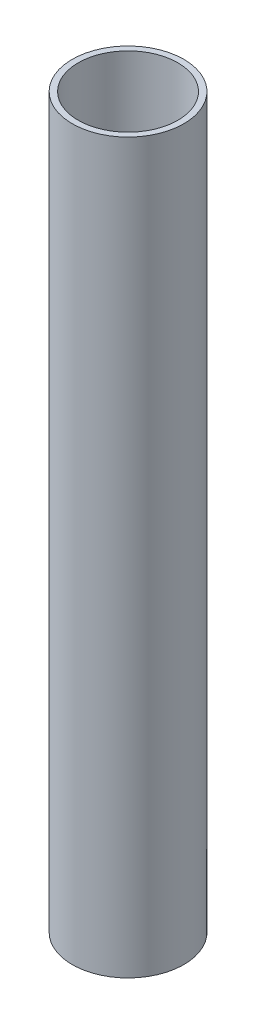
SolidWorks part; units mm, degrees
ref_plane "Front Plane" through (0, 0, 0) normal (0, 0, 1) x (1, 0, 0)
ref_plane "Top Plane" through (0, 0, 0) normal (0, 1, 0) x (1, 0, 0)
ref_plane "Right Plane" through (0, 0, 0) normal (1, 0, 0) x (0, 0, -1)
sketch "Sketch1" plane through (0, 0, 0) normal (0, 1, 0) x (1, 0, 0)
  circle A0 centre (0, 0) radius 6.35 construction
  circle A1 centre (0, 0) radius 7.35 construction
  circle A2 centre (0, 0) radius 8.35
  circle A3 centre (0, 0) radius 9.35
  dimension "D1" = 12.7
  dimension "D2" = 1
  dimension "D3" = 1
  dimension "D4" = 1
extrude "Boss-Extrude1" add sketch "Sketch1" along normal blind 122
